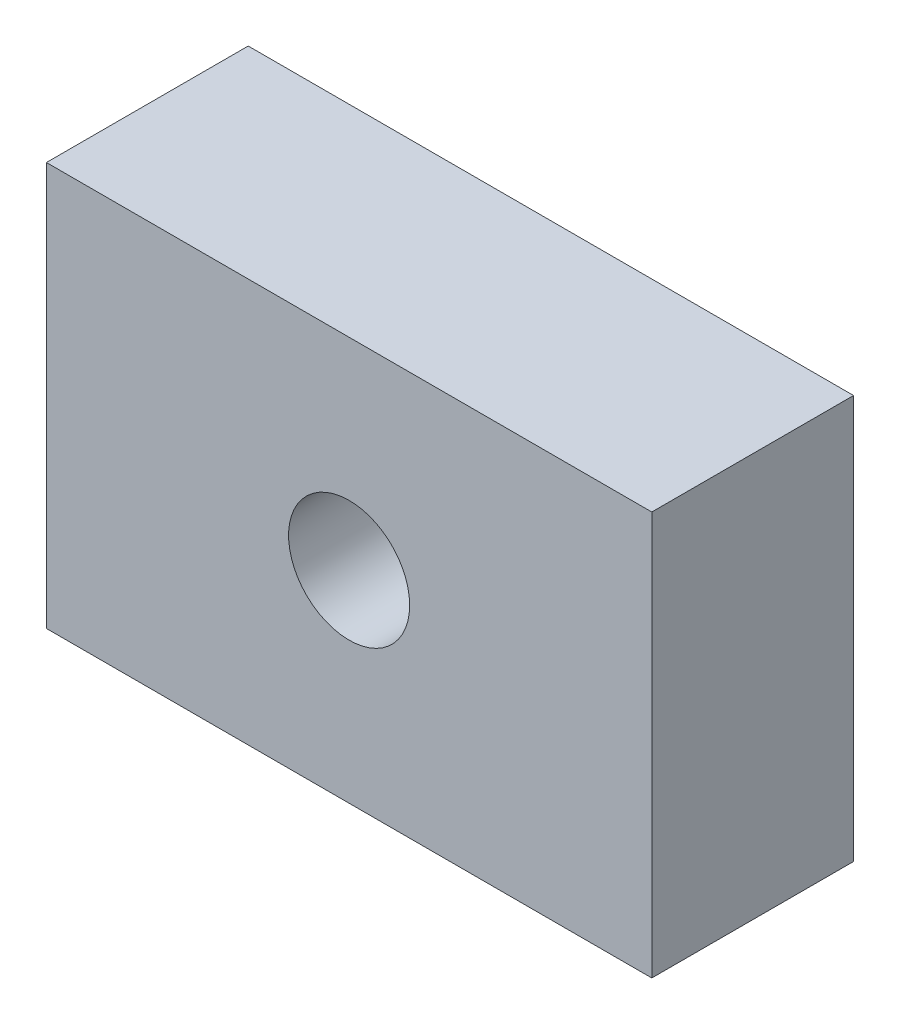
SolidWorks part; units mm, degrees
ref_plane "Płaszczyzna przednia" through (0, 0, 0) normal (0, 0, 1) x (1, 0, 0)
ref_plane "Płaszczyzna górna" through (0, 0, 0) normal (0, 1, 0) x (1, 0, 0)
ref_plane "Płaszczyzna prawa" through (0, 0, 0) normal (1, 0, 0) x (0, 0, -1)
sketch "Szkic1" plane through (0, 0, 0) normal (0, 0, 1) x (1, 0, 0)
  line L1 (100, -66.6667) -> (-100, -66.6667)
  line L2 (100, -66.6667) -> (100, 66.6667)
  line L3 (100, 66.6667) -> (-100, 66.6667)
  line L4 (-100, -66.6667) -> (-100, 66.6667)
  line L5 (100, -66.6667) -> (-100, 66.6667) construction
  line L6 (100, 66.6667) -> (-100, -66.6667) construction
  point P0 (0, 0)
extrude "Prostopadłościan" add sketch "Szkic1" along normal blind 66.6667
sketch "Szkic2" plane through (0, 0, 66.6667) normal (0, 0, 1) x (1, 0, 0)
  circle A0 centre (0, 0) radius 20
  dimension "Średnica" = 40
extrude "Otwór" cut sketch "Szkic2" against normal through all
equation "\"Parametr\"= 100"
equation "\"Długość@Szkic1\" = \"Parametr\" * 2"
equation "\"Szerokość@Szkic1\"= \"Parametr\" * 4 / 3"
equation "\"Wysokość@Prostopadłościan\" = \"Szerokość@Szkic1\" / 2"
equation "\"Otwór\"= IIF ( \"Parametr\" < 60 , \"suppressed\" , \"unsuppressed\" )"
